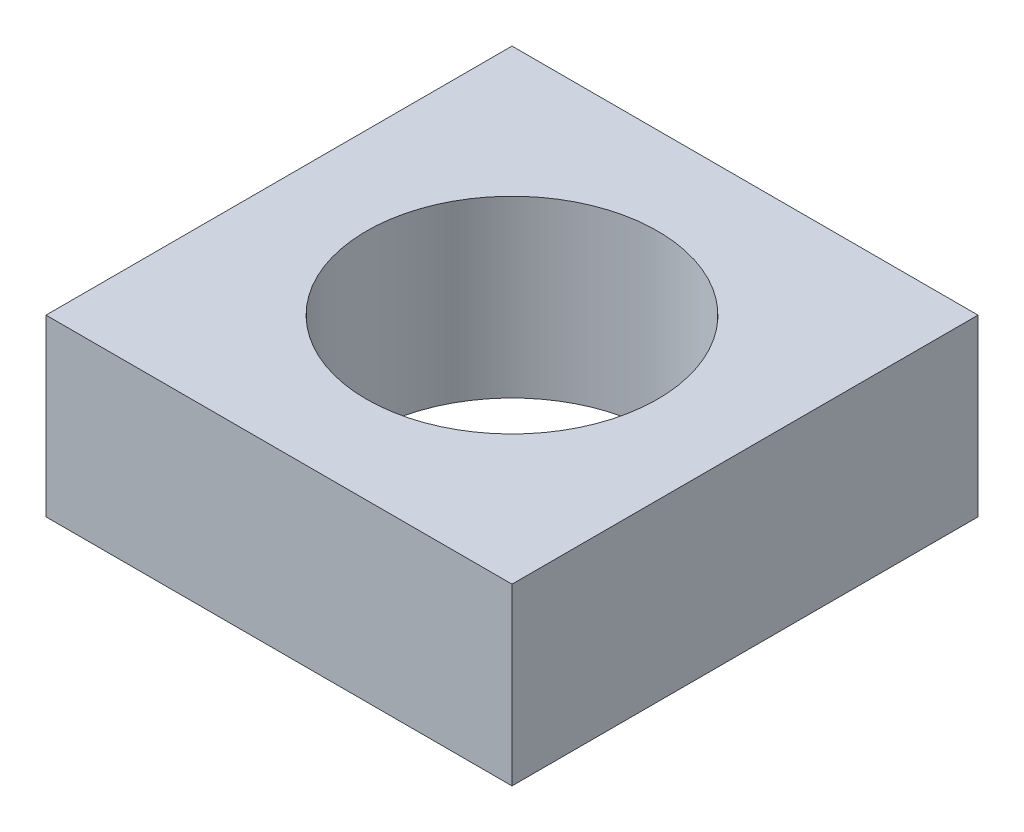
SolidWorks part; units mm, degrees
ref_plane "Front Plane" through (0, 0, 0) normal (0, 0, 1) x (1, 0, 0)
ref_plane "Top Plane" through (0, 0, 0) normal (0, 1, 0) x (1, 0, 0)
ref_plane "Right Plane" through (0, 0, 0) normal (1, 0, 0) x (0, 0, -1)
sketch "Sketch1" plane through (0, 0, 0) normal (0, 1, 0) x (1, 0, 0)
  line L1 (-4, 4) -> (4, 4)
  line L2 (-4, 4) -> (-4, -4)
  line L3 (-4, -4) -> (4, -4)
  line L4 (4, 4) -> (4, -4)
  line L5 (-4, 4) -> (4, -4) construction
  line L6 (-4, -4) -> (4, 4) construction
  circle A0 centre (0, 0) radius 2.5
  point P0 (0, 0)
  dimension "D3" = 5
  dimension "D1" = 8
  dimension "D2" = 8
extrude "Boss-Extrude1" add sketch "Sketch1" along normal blind 3
